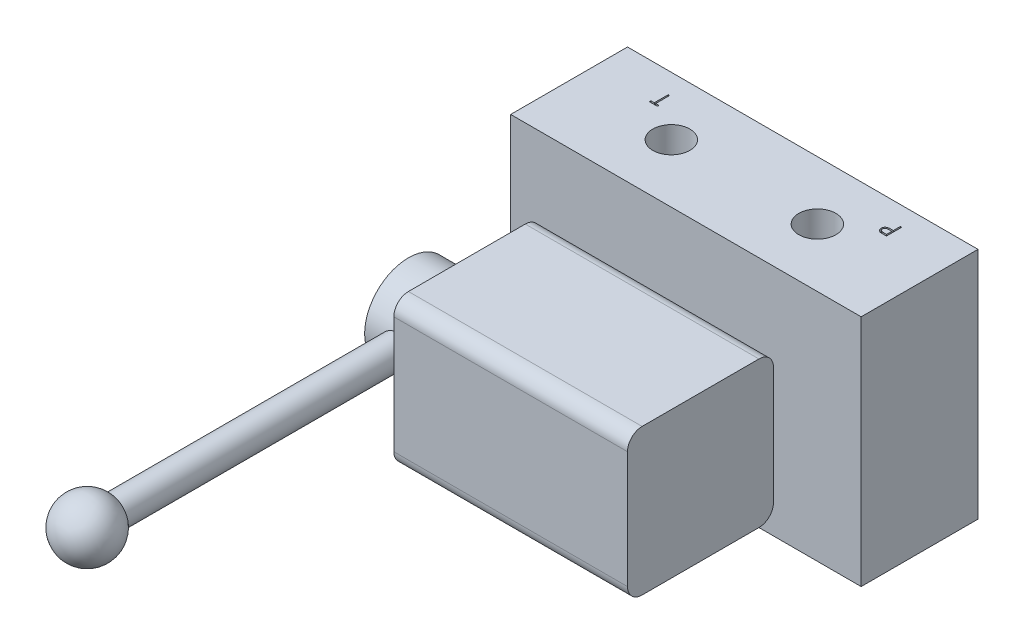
SolidWorks part; units mm, degrees
ref_plane "Płaszczyzna przednia" through (0, 0, 0) normal (0, 0, 1) x (1, 0, 0)
ref_plane "Płaszczyzna górna" through (0, 0, 0) normal (0, 1, 0) x (1, 0, 0)
ref_plane "Płaszczyzna prawa" through (0, 0, 0) normal (1, 0, 0) x (0, 0, -1)
sketch "Szkic1" plane through (0, 0, 0) normal (0, 0, 1) x (1, 0, 0)
  line L1 (60, -40) -> (-60, -40)
  line L2 (60, -40) -> (60, 40)
  line L3 (60, 40) -> (-60, 40)
  line L4 (-60, -40) -> (-60, 40)
  line L5 (60, -40) -> (-60, 40) construction
  line L6 (60, 40) -> (-60, -40) construction
  point P0 (0, 0)
  dimension "D1" = 80
  dimension "D2" = 120
extrude "Dodanie-wyciągnięcie1" add sketch "Szkic1" along normal mid plane 40
sketch "Szkic2" plane through (0, 0, 20) normal (0, 0, 1) x (1, 0, 0)
  line L1 (25, -10) -> (-25, -10)
  line L2 (25, -10) -> (25, 10)
  line L3 (25, 10) -> (-25, 10)
  line L4 (-25, -10) -> (-25, 10)
  line L5 (25, -10) -> (-25, 10) construction
  line L6 (25, 10) -> (-25, -10) construction
  point P0 (0, 0)
  dimension "D1" = 50
  dimension "D2" = 20
extrude "Dodanie-wyciągnięcie2" add sketch "Szkic2" along normal blind 10
sketch "Szkic3" plane through (0, 0, 30) normal (0, 0, 1) x (1, 0, 0)
  line L1 (40, -25) -> (-40, -25)
  line L2 (40, -25) -> (40, 25)
  line L3 (40, 25) -> (-40, 25)
  line L4 (-40, -25) -> (-40, 25)
  line L5 (40, -25) -> (-40, 25) construction
  line L6 (40, 25) -> (-40, -25) construction
  point P0 (0, 0)
  dimension "D1" = 80
  dimension "D2" = 50
extrude "Dodanie-wyciągnięcie3" add sketch "Szkic3" along normal blind 50
sketch "Szkic4" plane through (-40, 0, 0) normal (-1, 0, 0) x (0, 0, 1)
  line L0 (80, 25) -> (30, -25) construction
  circle A0 centre (55, 0) radius 15
  dimension "D1" = 30
extrude "Dodanie-wyciągnięcie4" add sketch "Szkic4" along normal blind 20
ref_plane "Płaszczyzna1" through (0, 0, 55) normal (0, 0, 1) x (1, 0, 0)
sketch "Szkic5" plane through (0, 0, 55) normal (0, 0, 1) x (1, 0, 0)
  line L0 (-60, 0) -> (-40, 0) construction
  line L1 (-40, 15) -> (-40, -15) construction
  circle A0 centre (-50, 0) radius 5
  dimension "D2" = 10
  dimension "D1" = 10
extrude "Dodanie-wyciągnięcie5" add sketch "Szkic5" along normal blind 120
sketch "Szkic6" plane through (0, 0, 175) normal (0, 0, 1) x (1, 0, 0)
  line L0 (-50, 10) -> (-50, -10)
  arc A0 (-50, 10) -> (-50, -10) centre (-50, 0) ccw
  dimension "D1" = 20
revolve "Obrót1" add sketch "Szkic6" angle 360 about L0
fillet "Zaokrąglenie1" radius 5 4 edges at (0, 25, 30) (0, 25, 80) (0, -25, 30) (0, -25, 80)
fillet "Zaokrąglenie2" radius 2 4 edges at (25, 0, 20) (0, 10, 20) (-25, 0, 20) (0, -10, 20)
sketch "Szkic7" plane through (0, -40, 0) normal (0, -1, 0) x (1, 0, 0)
  circle A0 centre (-25, 0) radius 6.35
  dimension "D2" = 12.7
  dimension "D1" = 25
extrude "Wytnij-wyciągnięcie1" cut sketch "Szkic7" against normal blind 20
mirror "Lustro1" about plane through (0, 0, 0) normal (1, 0, 0) of "Wytnij-wyciągnięcie1"
mirror "Lustro2" about plane through (0, 0, 0) normal (0, 1, 0) of "Lustro1", "Wytnij-wyciągnięcie1"
sketch "Szkic8" plane through (0, -40, 0) normal (0, -1, 0) x (1, 0, 0)
  text T0 "A" font "Century Gothic" height in points 20
extrude "Wytnij-wyciągnięcie2" cut sketch "Szkic8" against normal blind 2
sketch "Szkic9" plane through (0, -40, 0) normal (0, -1, 0) x (1, 0, 0)
  text T0 "B" font "Century Gothic" height in points 20
extrude "Wytnij-wyciągnięcie3" cut sketch "Szkic9" against normal blind 2
sketch "Szkic10" plane through (0, 40, 0) normal (0, 1, 0) x (1, 0, 0)
  text T0 "<r180>P</r>" font "Century Gothic" height in points 20
extrude "Wytnij-wyciągnięcie4" cut sketch "Szkic10" against normal blind 2
sketch "Szkic11" plane through (0, 40, 0) normal (0, 1, 0) x (1, 0, 0)
  text T0 "<r180>T</r>" font "Century Gothic" height in points 20
extrude "Wytnij-wyciągnięcie5" cut sketch "Szkic11" against normal blind 2
